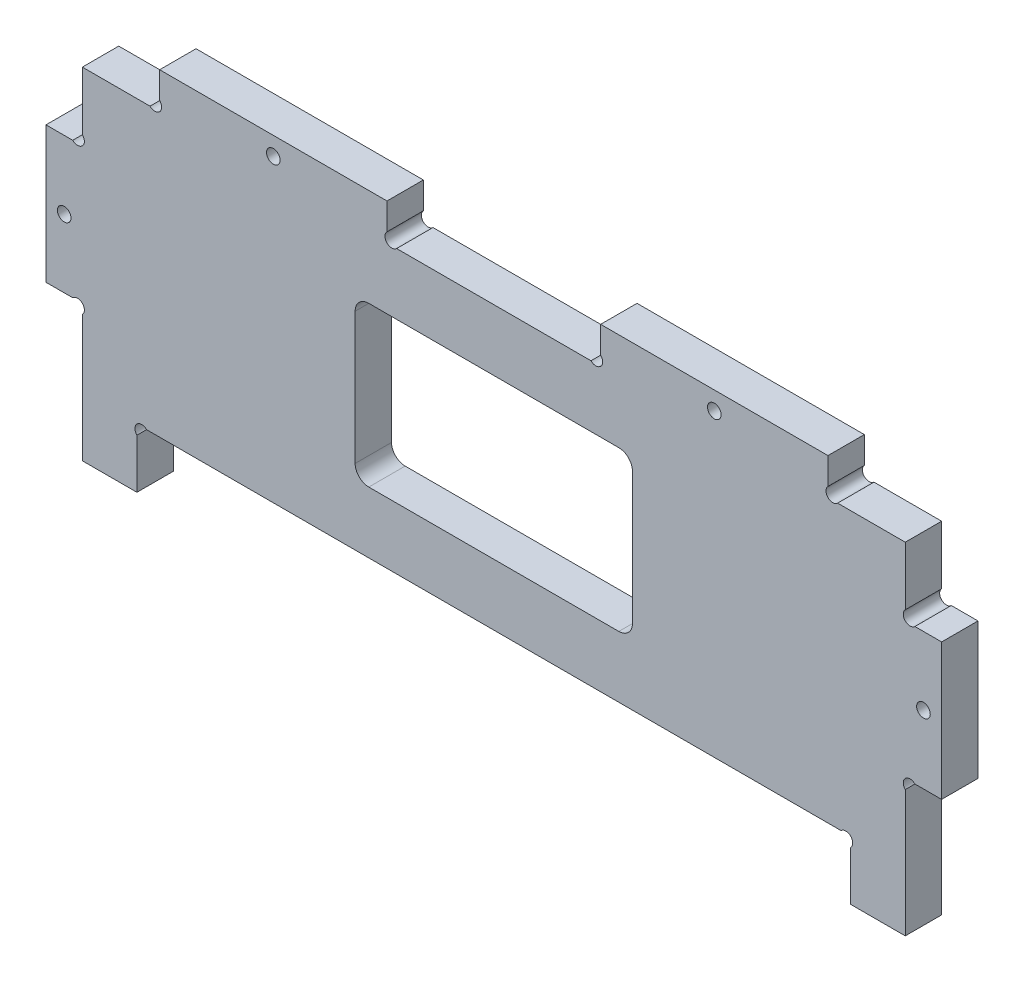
SolidWorks part; units mm, degrees
ref_plane "Plan de face" through (0, 0, 0) normal (0, 0, 1) x (1, 0, 0)
ref_plane "Plan de dessus" through (0, 0, 0) normal (0, 1, 0) x (1, 0, 0)
ref_plane "Plan de droite" through (0, 0, 0) normal (1, 0, 0) x (0, 0, -1)
sketch "Esquisse1" plane through (0, 0, 0) normal (0, 0, 1) x (1, 0, 0)
  line L0 (-46.1644, 25.4633) -> (145.8356, -36.5367) construction
  line L1 (56.8356, 44.3822) -> (56.8356, -71.661) construction
  line L2 (-21.0431, -36.5367) -> (24.7143, -36.5367)
  line L3 (145.8356, -22.0974) -> (145.8356, -21.658)
  line L4 (147.9569, -19.5367) -> (153.8356, -19.5367)
  line L5 (24.8356, -20.0367) -> (24.8356, 8.9633) construction
  line L6 (145.8356, -36.5367) -> (145.8356, -19.5367) construction
  line L7 (-35.1644, -36.5367) -> (-35.1644, -49.5367)
  line L8 (-43.1644, 10.4633) -> (-35.1644, -19.5367) construction
  line L9 (27.8356, 11.9633) -> (82.8356, 11.9633) construction
  line L10 (-23.1644, -36.5367) -> (-3.8116, -55.8895) construction
  line L11 (133.8356, -36.5367) -> (106.5836, -63.7887) construction
  line L12 (-18.1644, 33.4633) -> (31.8356, 25.4633) construction
  line L13 (156.8356, 25.4633) -> (-35.1644, -36.5367) construction
  line L14 (-20.2857, 25.4633) -> (-35.1644, 25.4633)
  line L15 (-18.1644, 33.4633) -> (-18.1644, 27.5846)
  line L16 (31.8356, 33.4633) -> (-18.1644, 33.4633)
  line L17 (31.8356, 27.5846) -> (31.8356, 33.4633)
  line L18 (153.8356, -19.5367) -> (153.8356, 10.4633)
  line L19 (145.8356, 13.0239) -> (145.8356, 25.4633)
  line L20 (145.8356, -36.5367) -> (145.8356, -22.0974)
  line L21 (153.8356, 10.4633) -> (147.9569, 10.4633)
  line L22 (-35.1644, 12.5846) -> (-35.1644, 13.0239)
  line L23 (-43.1644, 10.4633) -> (-37.2857, 10.4633)
  line L24 (-35.1644, -36.5367) -> (-35.1644, -22.0974)
  line L25 (-35.1644, 13.0239) -> (-35.1644, 25.4633)
  line L26 (145.8356, 12.5846) -> (145.8356, 13.0239)
  line L27 (128.8356, 33.4633) -> (78.8356, 25.4633) construction
  line L28 (-43.1644, -19.5367) -> (-43.1644, 10.4633)
  line L29 (-46.1644, 33.4633) -> (153.8356, 33.4633) construction
  line L30 (24.7143, -36.5367) -> (131.7143, -36.5367)
  line L32 (-37.2857, -19.5367) -> (-43.1644, -19.5367)
  line L33 (78.8356, 27.5846) -> (78.8356, 33.4633)
  line L34 (78.8356, 33.4633) -> (128.8356, 33.4633)
  line L35 (128.8356, 33.4633) -> (128.8356, 27.5846)
  line L36 (130.9569, 25.4633) -> (145.8356, 25.4633)
  line L37 (153.8356, 10.4633) -> (145.8356, -19.5367) construction
  line L39 (82.8356, -23.0367) -> (27.8356, -23.0367) construction
  line L40 (85.8356, 8.9633) -> (85.8356, -20.0367) construction
  line L41 (53.8356, 44.3822) -> (53.8356, -71.661) construction
  line L42 (-35.1644, -22.0974) -> (-35.1644, -21.658)
  line L43 (55.3356, 42.6899) -> (55.3356, -74.3203) construction
  line L44 (-35.1644, -49.5367) -> (-23.1644, -49.5367)
  line L45 (76.7143, 25.4633) -> (33.9569, 25.4633)
  line L47 (24.8356, 11.9633) -> (85.8356, 11.9633)
  line L48 (24.8356, 11.9633) -> (24.8356, -23.0367)
  line L49 (24.8356, -23.0367) -> (85.8356, -23.0367)
  line L50 (85.8356, 11.9633) -> (85.8356, -23.0367)
  line L53 (-23.1644, -49.5367) -> (-23.1644, -38.658)
  line L54 (145.8356, -36.5367) -> (145.8356, -49.5367)
  line L55 (145.8356, -49.5367) -> (133.8356, -49.5367)
  line L56 (133.8356, -49.5367) -> (133.8356, -38.658)
  circle A0 centre (-39.1644, -4.5367) radius 1.5
  arc A1 (-21.0431, -36.5367) -> (-23.1644, -38.658) centre (-22.1037, -37.5974) ccw
  circle A2 centre (6.8356, 29.4633) radius 1.5
  arc A3 (133.8356, -38.658) -> (131.7143, -36.5367) centre (132.7749, -37.5974) ccw
  arc A4 (-18.1644, 27.5846) -> (-20.2857, 25.4633) centre (-19.2251, 26.5239) cw
  arc A5 (33.9569, 25.4633) -> (31.8356, 27.5846) centre (32.8963, 26.5239) cw
  arc A6 (-35.1644, 12.5846) -> (-37.2857, 10.4633) centre (-36.2251, 11.5239) cw
  arc A7 (147.9569, -19.5367) -> (145.8356, -21.658) centre (146.8963, -20.5974) ccw
  arc A8 (145.8356, 12.5846) -> (147.9569, 10.4633) centre (146.8963, 11.5239) ccw
  arc A9 (-37.2857, -19.5367) -> (-35.1644, -21.658) centre (-36.2251, -20.5974) cw
  arc A11 (76.7143, 25.4633) -> (78.8356, 27.5846) centre (77.7749, 26.5239) ccw
  arc A12 (128.8356, 27.5846) -> (130.9569, 25.4633) centre (129.8963, 26.5239) ccw
  circle A15 centre (103.8356, 29.4633) radius 1.5
  circle A16 centre (149.8356, -4.5367) radius 1.5
  dimension "D3" = 45
  dimension "D7" = 0
  dimension "D2" = 50
  dimension "D9" = 0
  dimension "D6" = 1.5
  dimension "D5" = 0
  dimension "D4" = 45
  dimension "D8" = 0
  dimension "D10" = 12
  dimension "D11" = 12
extrude "Boss.-Extru.1" add sketch "Esquisse1" along normal blind 8
fillet "Congé1" radius 3 4 edges at (24.8356, -23.0367, 4) (85.8356, -23.0367, 4) (85.8356, 11.9633, 4) (24.8356, 11.9633, 4)
